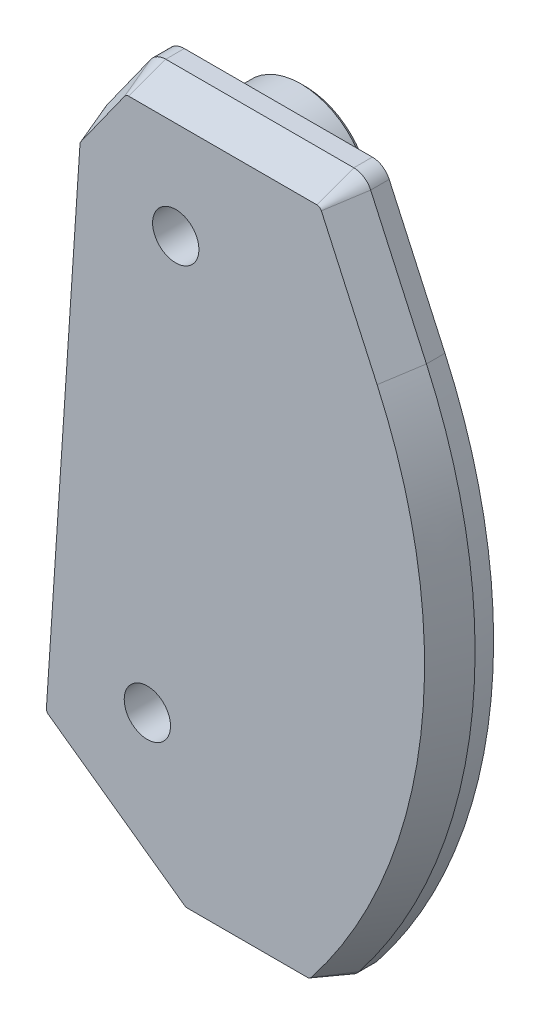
SolidWorks part; units mm, degrees
ref_plane "Płaszczyzna przednia" through (0, 0, 0) normal (0, 0, 1) x (1, 0, 0)
ref_plane "Płaszczyzna górna" through (0, 0, 0) normal (0, 1, 0) x (1, 0, 0)
ref_plane "Płaszczyzna prawa" through (0, 0, 0) normal (1, 0, 0) x (0, 0, -1)
sketch "Szkic1" plane through (0, 0, 0) normal (0, 0, 1) x (1, 0, 0)
  line L0 (-21.5318, 13.1121) -> (-21.5318, 38.1121)
  line L1 (-21.5318, 13.1121) -> (-21.5318, -11.8879)
  circle A0 centre (-21.5318, 38.1121) radius 5
  circle A1 centre (-21.5318, -11.8879) radius 5
  arc A2 (-32.6725, -37.6211) -> (-4.2416, 23.1121) centre (-61.9633, 13.1121) ccw
  arc A3 (-4.2395, 23.1121) -> (-32.6704, 63.8452) centre (-61.9612, 13.1121) ccw
  dimension "D1" = 10
sketch "Szkic2" plane through (0, 0, 0) normal (0, 0, 1) x (1, 0, 0)
  line L0 (-16.5431, 50.1121) -> (-33.5318, 50.1121)
  line L1 (-33.5318, 50.1121) -> (-33.5318, -23.8879)
  line L2 (-33.5318, -23.8879) -> (-16.5431, -23.8879)
  arc A1 (-4.2395, 23.1121) -> (-32.6704, 63.8452) centre (-61.9612, 13.1121) ccw construction
  arc A2 (-16.5431, -23.8879) -> (-16.5431, 50.1121) centre (-61.9612, 13.1121) ccw
  dimension "D4" = 58.5816
  dimension "D1" = 12
  dimension "D2" = 12
  dimension "D3" = 12
extrude "Dodanie-wyciągnięcie1" add sketch "Szkic2" along normal blind 6
fillet "Zaokrąglenie1" radius 2 4 edges at (-16.5431, -23.8879, 3) (-33.5318, -23.8879, 3) (-16.5431, 50.1121, 3) (-33.5318, 50.1121, 3)
sketch "Szkic3" plane through (0, 0, 6) normal (0, 0, 1) x (1, 0, 0)
  line L0 (-9.0875, 37.1504) -> (-24.3178, 70.6504) construction
  line L1 (-71.3288, 4.8728) -> (-49.1265, -10.9941) construction
  line L2 (-62.0839, 17.8089) -> (-71.3288, 4.8728) construction
  line L3 (-24.3178, 70.6504) -> (-61.5007, 18.6213) construction
  line L4 (-9.0875, 37.1504) -> (-24.3178, 70.6504)
  line L5 (-71.3288, 4.8728) -> (-49.1265, -10.9941)
  line L6 (-62.0839, 17.8089) -> (-71.3288, 4.8728)
  line L7 (-24.3178, 70.6504) -> (-61.5007, 18.6213)
  line L8 (-23.8626, 70.8573) -> (-8.6323, 37.3573) construction
  line L9 (-23.8626, 70.8573) -> (-8.6323, 37.3573)
  circle A0 centre (-34.7633, -6.3251) radius 7 construction
  circle A1 centre (-31.699, 39.7697) radius 7.5 construction
  circle A2 centre (-34.7633, -6.3251) radius 7
  circle A3 centre (-31.699, 39.7697) radius 7.5
sketch "Szkic4" plane through (0, 0, 6) normal (0, 0, 1) x (1, 0, 0)
  line L0 (-71.327, 4.8716) -> (-33.5143, -22.1515)
  line L1 (-71.3288, 4.8728) -> (-49.1265, -10.9941) construction
  line L2 (-8.6323, 37.3573) -> (-23.9821, 71.1201)
  line L3 (-23.9821, 71.1201) -> (-71.327, 4.8716)
  line L4 (-23.8626, 70.8573) -> (-8.6323, 37.3573) construction
  line L5 (-24.3178, 70.6504) -> (-61.5007, 18.6213) construction
  line L6 (-17.5037, 50.1121) -> (-31.5318, 50.1121) construction
  line L7 (-33.5318, 48.1121) -> (-33.5318, -21.8879) construction
  line L8 (-17.5037, 50.1121) -> (-31.5318, 50.1121)
  line L9 (-33.5318, 48.1121) -> (-33.5318, -21.8879)
  arc A0 (-33.5318, -21.8879) -> (-31.5318, -23.8879) centre (-31.5318, -21.8879) ccw construction
  arc A1 (-15.9322, -23.1251) -> (-15.9322, 49.3492) centre (-61.9612, 13.1121) ccw construction
  arc A2 (-8.6323, 37.3573) -> (-15.9322, 49.3492) centre (-61.9612, 13.1121) ccw
  arc A3 (-31.5318, 50.1121) -> (-33.5318, 48.1121) centre (-31.5318, 48.1121) ccw construction
  arc A4 (-31.5318, 50.1121) -> (-33.5318, 48.1121) centre (-31.5318, 48.1121) ccw
  arc A5 (-15.9322, 49.3492) -> (-17.5037, 50.1121) centre (-17.5037, 48.1121) ccw construction
  arc A6 (-15.9322, 49.3492) -> (-17.5037, 50.1121) centre (-17.5037, 48.1121) ccw
  arc A7 (-33.5318, -21.8879) -> (-33.5143, -22.1515) centre (-31.5318, -21.8879) ccw
extrude "Dodanie-wyciągnięcie2" add sketch "Szkic4" against normal up to surface (6 mm away)
sketch "Szkic6" plane through (0, 0, 0) normal (0, 0, -1) x (-1, 0, 0)
  circle A0 centre (34.7633, -6.3251) radius 7 construction
  circle A1 centre (31.699, 39.7697) radius 7.5 construction
  circle A2 centre (34.7633, -6.3251) radius 7
  circle A3 centre (31.699, 39.7697) radius 7.5
extrude "Dodanie-wyciągnięcie4" add sketch "Szkic6" along normal blind 8
sketch "Szkic7" plane through (0, 0, 0) normal (0, 0, -1) x (-1, 0, 0)
  line L0 (15.1869, 51.7744) -> (37.8077, 51.7744)
  line L1 (23.9821, 71.1201) -> (8.6323, 37.3573) construction
  line L2 (71.327, 4.8716) -> (23.9821, 71.1201) construction
  line L3 (31.699, 39.7697) -> (34.7633, -6.3251) construction
  line L4 (31.5318, -23.8879) -> (17.5037, -23.8879) construction
  line L5 (43.4525, 43.8757) -> (47.1921, -12.3766)
  line L6 (33.5143, -22.1515) -> (71.327, 4.8716) construction
  line L7 (15.1869, 51.7744) -> (10.8902, 88.2324)
  line L8 (10.8902, 88.2324) -> (96.1046, 89.1771)
  line L9 (96.1046, 89.1771) -> (95.3489, -24.3792)
  line L11 (37.8077, 51.7744) -> (43.4525, 43.8757)
  line L12 (47.1921, -12.3766) -> (9.9607, -38.9843)
  line L13 (9.9607, -38.9843) -> (95.3489, -24.3792)
  dimension "D1" = 17.5628
  dimension "D2" = 12.0047
  dimension "D3" = 12
extrude "Wytnij-wyciągnięcie1" cut sketch "Szkic7" against normal through all
fillet "Zaokrąglenie2" radius 2 5 edges at (-15.1869, 51.7744, 3) (-37.8077, 51.7744, 3) (-43.4525, 43.8757, 3) (-47.1921, -12.3766, 3) (-31.0846, -23.8879, 3)
hole_wizard "Otwór Ø5.0 (5)1" positions "Szkic8" profile "Szkic9" hole size "Ø5.0" standard "DIN"
sketch "Szkic8" plane through (0, 0, -8) normal (0, 0, -1) x (-1, 0, 0)
  point P0 (31.699, 39.7697)
  point P3 (34.7633, -6.3251)
sketch "Szkic9" plane through (-31.699, 39.7697, -8) normal (1, 0, 0) x (0, 1, 0)
  line L0 (0, 0) -> (0, 14)
  line L1 (0, 14) -> (2.5, 14)
  line L2 (2.5, 14) -> (2.5, 0)
  line L5 (2.5, 0) -> (0, 0)
  line L11 (0, -6.35) -> (0, 107.95) construction
  dimension "Średnica otworu na wylot" = 5
  dimension "Głębokość otworu na wylot" = 14
chamfer "Sfazowanie1" distance 0.5 angle 45 2 edges at (-39.199, 39.7697, -8) (-41.7633, -6.3251, -8)
chamfer "Sfazowanie2" distance 4 angle 20 13 edges at (-45.3042, 16.0218, 6) (-43.3779, 43.849, 6) (-46.9304, -12.2528, 6) (-40.7639, 47.6378, 6) (-38.9459, -18.2698, 6) (-37.6937, 51.5528, 6) (-31.054, -23.7925, 6) (-26.6267, 51.7744, 6) (-23.9735, -23.8879, 6) (-15.3919, 51.456, 6) (-16.6302, -23.6871, 6) (-11.6431, 43.9797, 6) (-3.8017, 6.0926, 6)
